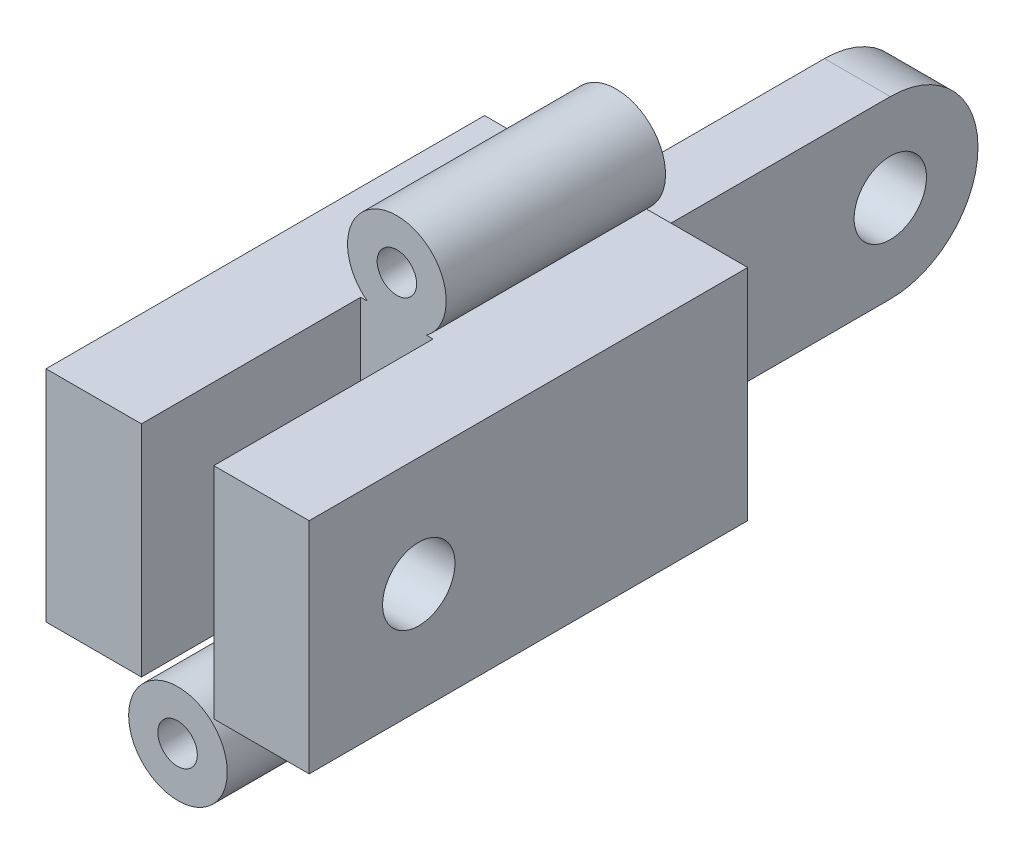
SolidWorks part; units mm, degrees
ref_plane "Front Plane" through (0, 0, 0) normal (0, 0, 1) x (1, 0, 0)
ref_plane "Top Plane" through (0, 0, 0) normal (0, 1, 0) x (1, 0, 0)
ref_plane "Right Plane" through (0, 0, 0) normal (1, 0, 0) x (0, 0, -1)
sketch "Sketch1" plane through (0, 0, 0) normal (0, 1, 0) x (1, 0, 0)
  line L0 (7.65, 0) -> (12, 0)
  line L1 (0, 0) -> (4.35, 0)
  line L2 (0, 0) -> (0, 20)
  line L3 (4.5, 35) -> (7.5, 35)
  line L4 (12, 0) -> (12, 20)
  line L7 (0, 20) -> (4.5, 20)
  line L8 (4.5, 35) -> (4.5, 20)
  line L11 (12, 20) -> (7.5, 20)
  line L12 (7.5, 35) -> (7.5, 20)
  line L14 (4.35, 0) -> (4.35, 10)
  line L15 (4.35, 10) -> (7.65, 10)
  line L16 (7.65, 0) -> (7.65, 10)
  dimension "D1" = 12
  dimension "D3" = 3.3
  dimension "D4" = 4.35
  dimension "D5" = 10
  dimension "D6" = 15
  dimension "D7" = 15
  dimension "D8" = 3
  dimension "D9" = 4.5
extrude "Boss-Extrude1" add sketch "Sketch1" along normal blind 10
sketch "Sketch2" plane through (7.5, 0, 0) normal (1, 0, 0) x (0, 0, -1)
  line L0 (35, 10) -> (35, 0) construction
  line L1 (20, 10) -> (35, 10) construction
  line L3 (20, 10) -> (35, 10)
  line L4 (20, 10) -> (20, 9)
  line L5 (20, 9) -> (35, 9)
  line L6 (35, 10) -> (35, 9)
  line L7 (20, 0) -> (35, 0)
  line L8 (20, 0) -> (20, 1)
  line L9 (20, 1) -> (35, 1)
  line L10 (35, 0) -> (35, 1)
  circle A0 centre (31, 5) radius 1.65
  dimension "D1" = 3.3
  dimension "D2" = 4
  dimension "D3" = 5
  dimension "D4" = 1
  dimension "D5" = 1
extrude "Cut-Extrude1" cut sketch "Sketch2" against normal blind 10
fillet "Fillet1" radius 4 2 edges at (6, 1, -35) (6, 9, -35)
sketch "Sketch3" plane through (12, 0, 0) normal (1, 0, 0) x (0, 0, -1)
  line L0 (0, 10) -> (0, 0) construction
  line L1 (0, 10) -> (20, 10) construction
  circle A0 centre (5, 5) radius 1.65
  dimension "D3" = 3.3
  dimension "D1" = 5
  dimension "D2" = 5
extrude "Cut-Extrude2" cut sketch "Sketch3" against normal through all
sketch "Sketch4" plane through (0, 0, -10) normal (0, 0, 1) x (1, 0, 0)
  line L0 (0, 10) -> (0, 0) construction
  line L1 (4.35, 10) -> (7.65, 10) construction
  circle A0 centre (6, 11.8) radius 2.25
  dimension "D1" = 6
  dimension "D2" = 4.5
  dimension "D3" = 1.8
extrude "Boss-Extrude2" add sketch "Sketch4" against normal blind 10
sketch "Sketch5" plane through (0, 0, -10) normal (0, 0, 1) x (1, 0, 0)
  line L0 (4.35, 0) -> (7.65, 0) construction
  line L1 (12, 10) -> (12, 0) construction
  circle A0 centre (6, -1.8) radius 2.25
  dimension "D1" = 4.5
  dimension "D2" = 1.8
  dimension "D3" = 6
sketch "Sketch6" plane through (0, 0, -20) normal (0, 0, -1) x (-1, 0, 0)
  line L0 (-12, 0) -> (0, 0) construction
  circle A0 centre (-6.018, -1.8) radius 2.25
  dimension "D1" = 4.5
  dimension "D2" = 1.8
extrude "Boss-Extrude3" add sketch "Sketch6" against normal blind 20
sketch "Sketch7" plane through (0, 0, -20) normal (0, 0, -1) x (-1, 0, 0)
  circle A0 centre (-6, -1.8) radius 0.9
  circle A1 centre (-6, 11.8) radius 0.9
  dimension "D1" = 1.8
  dimension "D2" = 1.8
extrude "Cut-Extrude3" cut sketch "Sketch7" against normal blind 20
